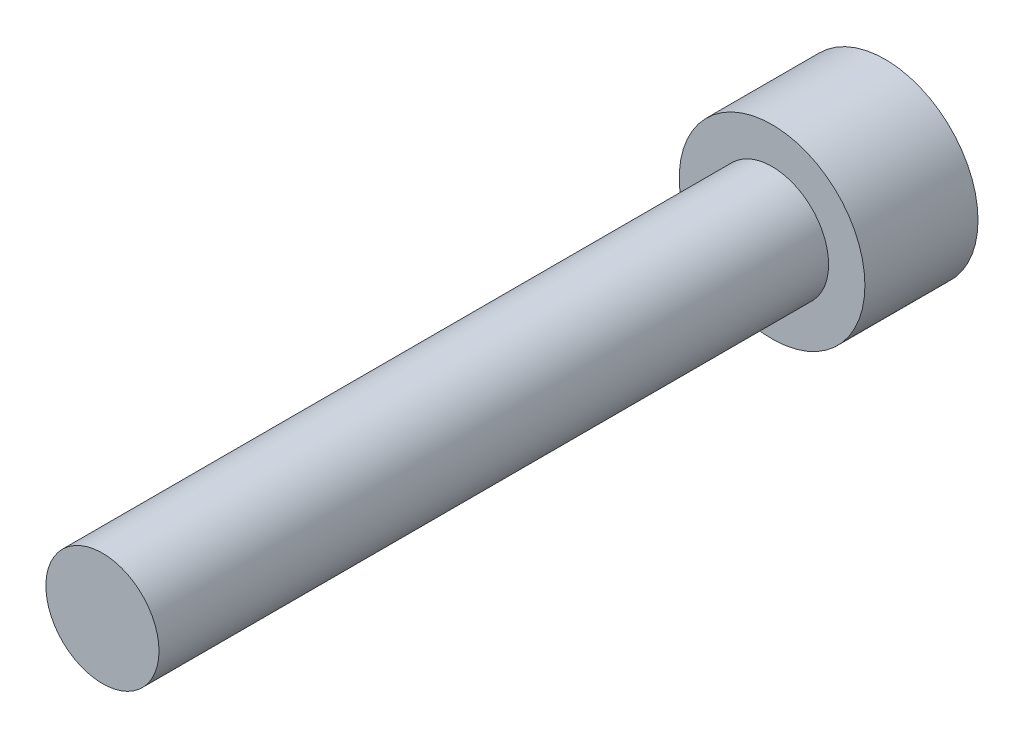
SolidWorks part; units mm, degrees
ref_plane "Front Plane" through (0, 0, 0) normal (0, 0, 1) x (1, 0, 0)
ref_plane "Top Plane" through (0, 0, 0) normal (0, 1, 0) x (1, 0, 0)
ref_plane "Right Plane" through (0, 0, 0) normal (1, 0, 0) x (0, 0, -1)
sketch "Sketch6" plane through (0, 0, 0) normal (1, 0, 0) x (0, 0, -1)
  line L0 (-28.575, 0) -> (22.525, 0) construction
  line L1 (4.3586, 0) -> (-4.3586, 0) construction
  line L2 (-28.575, 0) -> (-28.575, -2.413)
  line L3 (-28.575, -2.413) -> (0, -2.413)
  line L4 (0, 4.3586) -> (0, -4.3586) construction
  line L5 (0, -2.413) -> (0, -3.9624)
  line L6 (0, -3.9624) -> (4.826, -3.9624)
  line L7 (4.826, -3.9624) -> (4.826, 0)
  line L8 (4.826, 0) -> (-28.575, 0)
  dimension "L" = 28.575
  dimension "H" = 4.826
  dimension "A" = 7.9248
  dimension "D" = 4.826
revolve "Revolve1" add sketch "Sketch6" angle 360 about L0
sketch "Sketch7" plane through (0, 0, -4.826) normal (0, 0, -1) x (-1, 0, 0)
  line L2 (-1.9812, 1.1438) -> (-1.9812, -1.1438)
  line L4 (-1.9812, -1.1438) -> (0, -2.2877)
  line L5 (0, -2.2877) -> (1.9812, -1.1438)
  line L6 (1.9812, -1.1438) -> (1.9812, 1.1438)
  line L7 (1.9812, 1.1438) -> (0, 2.2877)
  line L8 (0, 2.2877) -> (-1.9812, 1.1438)
  circle A0 centre (0, 0) radius 1.9812 construction
  dimension "J" = 3.9624
extrude "HEX" cut sketch "Sketch7" against normal blind 3.048
